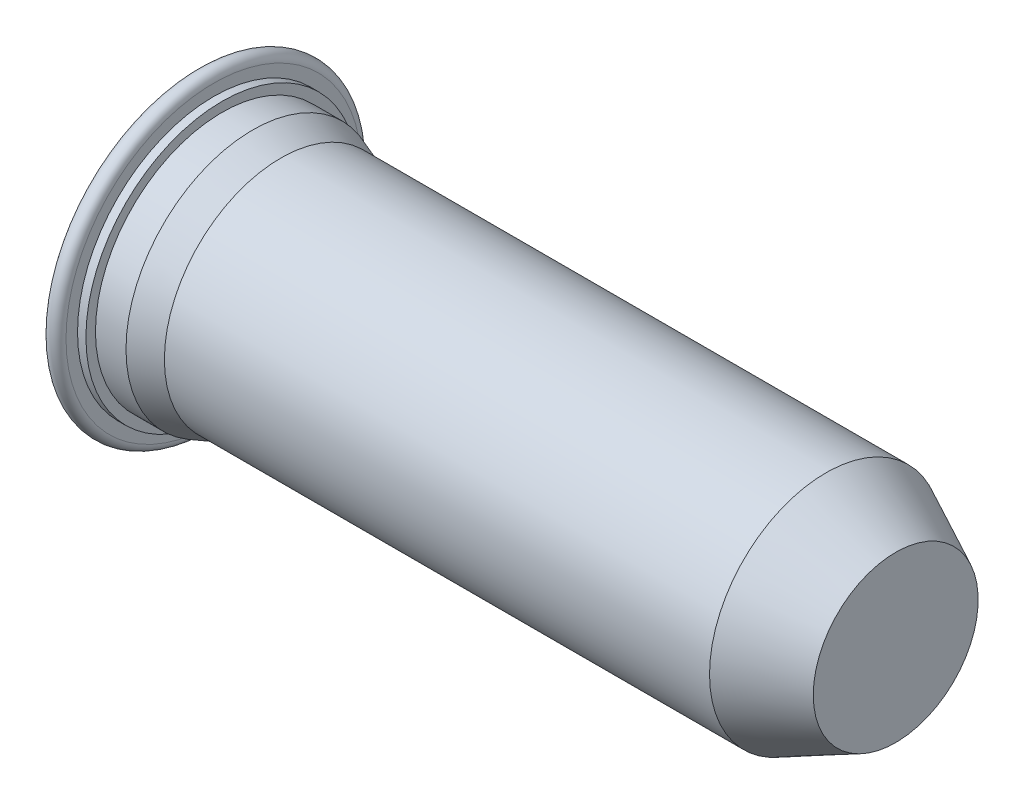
SolidWorks part; units mm, degrees
ref_plane "Plane1" through (0, 0, 0) normal (0, 0, 1) x (1, 0, 0)
ref_plane "Plane2" through (0, 0, 0) normal (0, 1, 0) x (1, 0, 0)
ref_plane "Plane3" through (0, 0, 0) normal (1, 0, 0) x (0, 0, -1)
sketch "BodySke" plane through (0, 0, 0) normal (0, 0, 1) x (1, 0, 0)
  line L0 (0, 0) -> (0, 4.0234)
  line L1 (0.4572, 4.0284) -> (0.4572, 3.7147)
  line L2 (19.05, 2.2479) -> (17.1492, 3.175)
  line L3 (2.286, 3.175) -> (17.1492, 3.175)
  line L4 (19.05, 2.2479) -> (19.05, 0)
  line L5 (19.05, 0) -> (0, 0)
  line L6 (0, 0) -> (50.554, 0) construction
  line L7 (0.4572, 3.7147) -> (0.6858, 3.7147)
  line L8 (1.5184, 3.4544) -> (0.6858, 3.4544)
  line L9 (-9.525, 4.2545) -> (9.525, 4.2545) construction
  line L10 (0.6858, 3.7147) -> (0.6858, 3.4544)
  line L11 (2.286, 3.175) -> (1.5184, 3.4544)
  line L13 (9.525, -4.2545) -> (-9.525, -4.2545) construction
  line L14 (0.0051, 4.0284) -> (0.0051, 4.0234)
  line L15 (0, 4.0234) -> (0.0051, 4.0234)
  arc A0 (0.0051, 4.0284) -> (0.4572, 4.0284) centre (0.2311, 4.0284) cw
  dimension "D2" = 0.0051
  dimension "D1" = 0.0051
  dimension "Diameter" = 6.35
  dimension "D3" = 20
  dimension "D4" = 64
  dimension "Length" = 19.05
  dimension "H_dia" = 8.509
  dimension "T_dim" = 0.4572
  dimension "Neck_len" = 2.286
  dimension "Neck_dia" = 6.9088
  dimension "D_dia" = 4.4958
  dimension "Clinch_dia" = 7.4295
  dimension "Clinch_ht" = 0.6858
revolve "BaseBody" add sketch "BodySke" angle 360 about L6
equation "' \"Diameter@BodySke\" = 0.25"
equation "' \"Length@BodySke\" = 0.75"
equation "' \"Neck_dia@BodySke\" = 0.272"
equation "' \"H_dia@BodySke\" = 0.335"
equation "' \"Neck_len@BodySke\" = 0.09"
equation "' \"D_dia@BodySke\" = 0.177"
equation "\"T_dim@BodySke\" = \"Neck_len@BodySke\" * 0.2"
equation "\"Clinch_dia@BodySke\" = ( \"H_dia@BodySke\" + \"Diameter@BodySke\" ) / 2"
equation "\"Clinch_ht@BodySke\" = \"T_dim@BodySke\" * 1.5"
